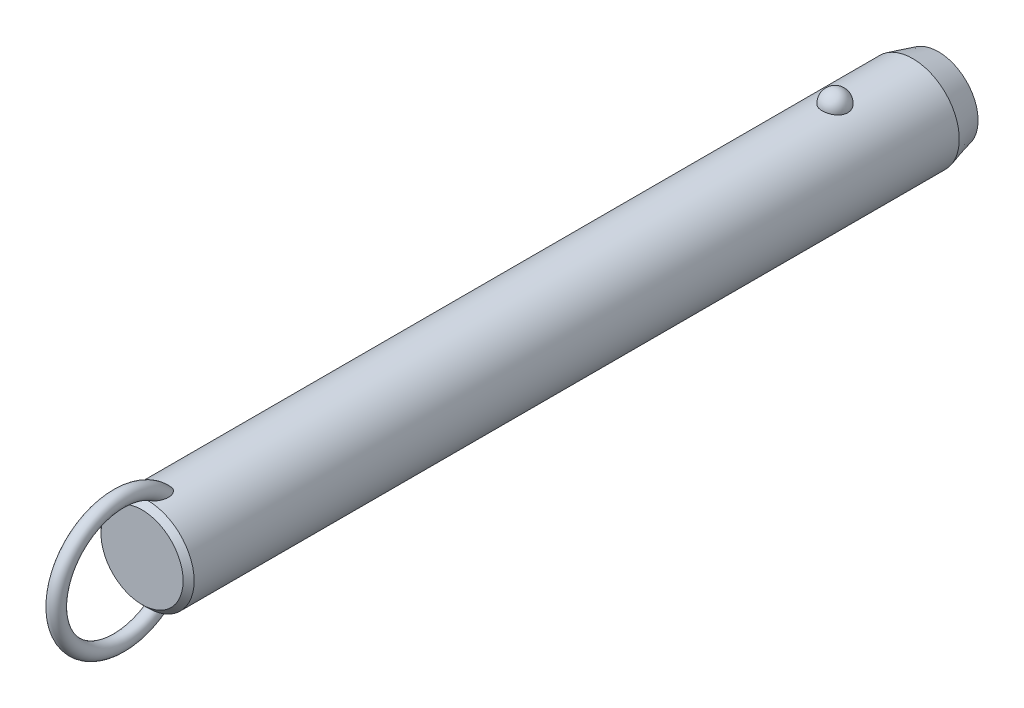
SolidWorks part; units mm, degrees
ref_plane "Front Plane" through (0, 0, 0) normal (0, 0, 1) x (1, 0, 0)
ref_plane "Top Plane" through (0, 0, 0) normal (0, 1, 0) x (1, 0, 0)
ref_plane "Right Plane" through (0, 0, 0) normal (1, 0, 0) x (0, 0, -1)
sketch "Sketch2" plane through (0, 0, 0) normal (0, 0, 1) x (1, 0, 0)
  circle A0 centre (0, 0) radius 12.7
  point P3 (0, 12.7)
  dimension "D1" = 25.4
extrude "Boss-Extrude1" add sketch "Sketch2" along normal blind 172.8
sketch "Sketch3" plane through (0, 0, 0) normal (0, 0, -1) x (-1, 0, 0)
  circle A0 centre (0, 0) radius 12.7
  dimension "D1" = 25.4
extrude "Boss-Extrude2" add sketch "Sketch3" along normal blind 31.7
chamfer "Chamfer1" distance 7 angle 15 1 edges at (-12.7, 0, -31.7)
sketch "Sketch12" plane through (0, 0, 0) normal (1, 0, 0) x (0, 0, -1)
  line L0 (-172.8, 12.7) -> (-172.8, -12.7) construction
  point P0 (-172.8, 0)
sketch "Sketch13" plane through (0, 0, 0) normal (1, 0, 0) x (0, 0, -1)
  circle A0 centre (-191.85, 0) radius 19.05
  point P2 (-172.8, 0)
  dimension "D1" = 38.1
sketch "Sketch14" plane through (0, 0, 0) normal (0, 1, 0) x (1, 0, 0)
  circle A0 centre (0, -174.8) radius 2
  point P2 (0, -172.8)
  dimension "D1" = 4
sweep "Sweep1" add profiles "Sketch14" path "Sketch13"
sketch "Sketch15" plane through (0, 0, 172.8) normal (0, 0, 1) x (1, 0, 0)
  circle A0 centre (0, 0) radius 12.7
  dimension "D1" = 25.4
extrude "Boss-Extrude3" add sketch "Sketch15" along normal blind 12.7
chamfer "Chamfer2" distance 1.5 angle 45 1 edges at (12.7, 0, 185.5)
sketch "Sketch18" plane through (0, 0, 0) normal (1, 0, 0) x (0, 0, -1)
  line L0 (24.7, 12.7) -> (-177.651, 12.7) construction
  line L1 (3.5, 16.2) -> (3.5, 9.2)
  line L2 (-177.651, -12.7) -> (24.7, -12.7) construction
  arc A0 (3.5, 16.2) -> (3.5, 9.2) centre (3.5, 12.7) ccw
  point P4 (0, 12.7)
  dimension "D1" = 28.9
revolve "Revolve1" add sketch "Sketch18" angle 360 about L1
